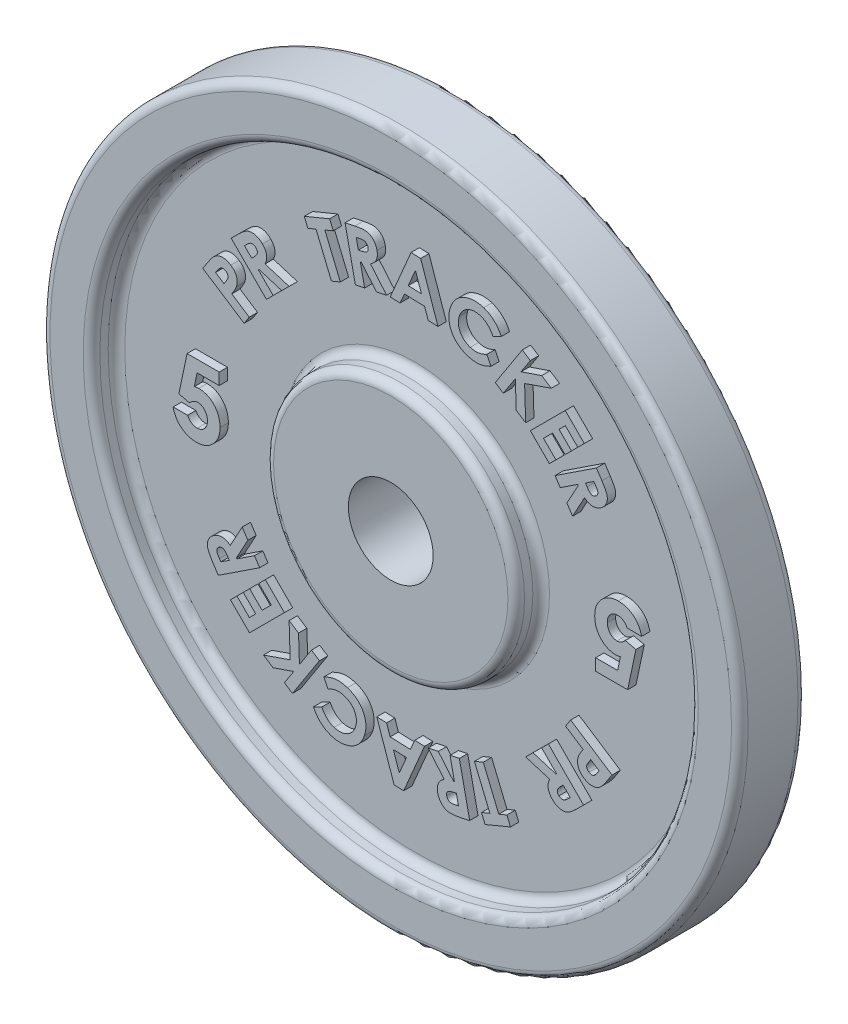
SolidWorks part; units mm, degrees
ref_plane "Plano frontal" through (0, 0, 0) normal (0, 0, 1) x (1, 0, 0)
ref_plane "Plano superior" through (0, 0, 0) normal (0, 1, 0) x (1, 0, 0)
ref_plane "Plano direito" through (0, 0, 0) normal (1, 0, 0) x (0, 0, -1)
sketch "Esboço1" plane through (0, 0, 0) normal (0, 0, 1) x (1, 0, 0)
  circle A0 centre (0, 0) radius 21
  circle A1 centre (0, 0) radius 2.55
  dimension "D1" = 42
  dimension "D2" = 5.1
extrude "Ressalto-extrusão1" add sketch "Esboço1" along normal blind 4
sketch "Esboço2" plane through (0, 0, 4) normal (0, 0, 1) x (1, 0, 0)
  circle A0 centre (0, 0) radius 18
  circle A1 centre (0, 0) radius 21
  circle A2 centre (0, 0) radius 21
  circle A5 centre (0, 0) radius 7.55
  circle A6 centre (0, 0) radius 7.55
  dimension "D1" = 0
  dimension "D2" = 3
  dimension "D3" = 5
extrude "Corte-extrusão1" cut sketch "Esboço2" against normal blind 1.5 contours A0 A6
fillet "Filete1" radius 0.5 4 edges at (7.55, 0, 2.5) (18, 0, 2.5) (7.55, 0, 4) (18, 0, 4)
sketch "Esboço3" plane through (0, 0, 2.5) normal (0, 0, 1) x (1, 0, 0)
  arc A0 (11.25, 0) -> (-11.25, 0) centre (0, 0) ccw construction
  text T0 "<b>PR  TRACKER</b>" font "Century Gothic" height 3
  dimension "D1" = 22.5
extrude "Ressalto-extrusão2" add sketch "Esboço3" along normal blind 0.5
sketch "Esboço5" plane through (0, 0, 2.5) normal (0, 0, 1) x (1, 0, 0)
  line L0 (-17.3735, -2.1) -> (-7.7713, -2.1) construction
  line L1 (0, 0) -> (-17.5, 0) construction
  circle A2 centre (0, 0) radius 17.5 construction
  circle A3 centre (0, 0) radius 8.05 construction
  text T0 "<b>5</b>" font "Century Gothic" height in points 16
  dimension "D1" = 2.1
extrude "Ressalto-extrusão3" add sketch "Esboço5" along normal blind 0.5
pattern_circular "PadrãoCircular1" count 2 over 360 about axis through (0, 0, 4) along (0, 0, 1) of "Ressalto-extrusão2", "Ressalto-extrusão3"
ref_plane "Plano1" through (0, 0, 2) normal (0, 0, 1) x (1, 0, 0)
fillet "Filete2" radius 0.5 2 edges at (21, 0, 0) (21, 0, 4)
mirror "Espelhar6" about plane through (0, 0, 2) normal (0, 0, 1) of "Corte-extrusão1"
fillet "Filete3" radius 0.5 3 edges at (18, 0, 1.5) (7.55, 0, 0) (18, 0, 0)
sketch "Esboço10" plane through (0, 0, 1.5) normal (0, 0, -1) x (-1, 0, 0)
  line L0 (-11.25, 0) -> (11.25, 0) construction
  arc A0 (11.25, 0) -> (-11.25, 0) centre (0, 0) ccw construction
  text T0 "<b>PR  TRACKER</b>" font "Century Gothic" height 3
  dimension "D1" = 22.5
extrude "Ressalto-extrusão4" add sketch "Esboço10" along normal blind 0.5
sketch "Esboço12" plane through (0, 0, 1.5) normal (0, 0, -1) x (-1, 0, 0)
  line L0 (-17.3735, -2.1) -> (-7.2521, -2.1) construction
  circle A0 centre (0, 0) radius 17.5 construction
  circle A1 centre (0, 0) radius 7.55 construction
  text T0 "<b>5</b>" font "Century Gothic" height in points 16
  dimension "D1" = 2.1
extrude "Ressalto-extrusão5" add sketch "Esboço12" along normal blind 0.5
pattern_circular "PadrãoCircular2" count 2 over 360 about axis through (0, 0, 0) along (0, 0, 1) of "Ressalto-extrusão4", "Ressalto-extrusão5"
